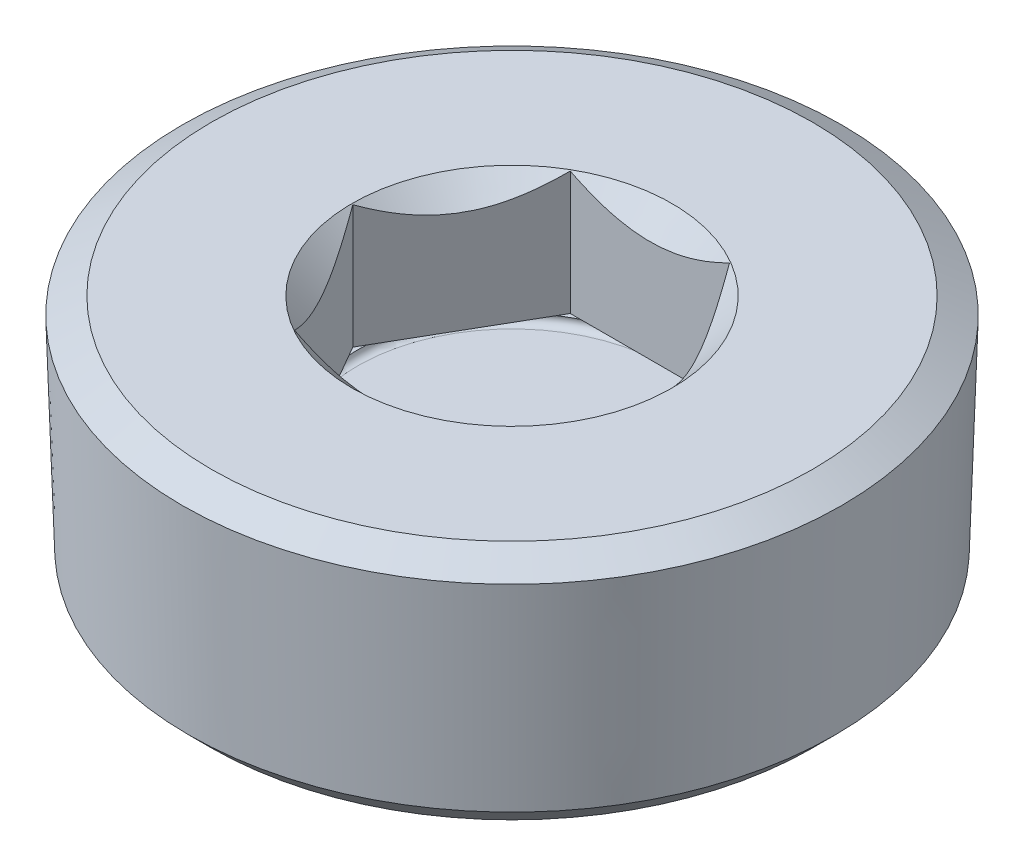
SolidWorks part; units mm, degrees
ref_plane "Front Plane" through (0, 0, 0) normal (0, 0, 1) x (1, 0, 0)
ref_plane "Top Plane" through (0, 0, 0) normal (0, 1, 0) x (1, 0, 0)
ref_plane "Right Plane" through (0, 0, 0) normal (1, 0, 0) x (0, 0, -1)
sketch "Sketch2" plane through (0, 0, 0) normal (0, 0, 1) x (1, 0, 0)
  line L0 (0, 10.7443) -> (0, -17.0657) construction
  line L1 (0, 0) -> (-27.6907, 0)
  line L2 (-30.3682, -1.5459) -> (-29.7882, -20.1275)
  line L3 (-27.6907, -22.225) -> (0, -22.225)
  line L4 (0, -22.225) -> (0, 0)
  line L6 (-27.6907, -22.225) -> (-29.7882, -20.1275)
  line L7 (-27.6907, 0) -> (-30.3682, -1.5459)
  point P4 (-30.4165, 0)
  point P6 (-29.7227, -22.225)
  dimension "D1" = 22.225
  dimension "D2" = 1.788
  dimension "D3" = 60.833
  dimension "D4" = 30
  dimension "D5" = 2.032
  dimension "D6" = 45
revolve "Revolve1" add sketch "Sketch2" angle 360 about L0
sketch "Sketch3" plane through (0, 0, 0) normal (0, 0, 1) x (1, 0, 0)
  line L0 (0, 2.9342) -> (0, -18.7525) construction
  line L1 (0, 0) -> (-14.732, 0)
  line L2 (27.6907, 0) -> (-27.6907, 0) construction
  line L3 (-12.7, -2.032) -> (-12.7, -11.43)
  line L4 (-14.224, -12.7) -> (0, -12.7)
  line L5 (0, -12.7) -> (0, 0)
  line L6 (-12.7, -2.032) -> (-14.732, 0)
  line L7 (-12.7, -11.43) -> (-14.224, -11.43)
  arc A0 (-14.224, -11.43) -> (-14.224, -12.7) centre (-14.224, -12.065) ccw
  dimension "D1" = 11.43
  dimension "D2" = 12.7
  dimension "D3" = 25.4
  dimension "D4" = 2.032
  dimension "D5" = 45
  dimension "D6" = 1.524
revolve "Cut-Revolve1" cut sketch "Sketch3" angle 360 about L0
sketch "Sketch4" plane through (0, 0, 0) normal (0, 1, 0) x (1, 0, 0)
  line L1 (-7.3323, -12.7) -> (7.3323, -12.7)
  line L2 (7.3323, -12.7) -> (14.6647, 0)
  line L3 (14.6647, 0) -> (7.3323, 12.7)
  line L4 (7.3323, 12.7) -> (-7.3323, 12.7)
  line L5 (-7.3323, 12.7) -> (-14.6647, 0)
  line L6 (-14.6647, 0) -> (-7.3323, -12.7)
  circle A0 centre (0, 0) radius 12.7 construction
  circle A1 centre (0, 0) radius 12.7 construction
  dimension "D1" = 25.4
extrude "Cut-Extrude1" cut sketch "Sketch4" against normal up to vertex (5.2929 mm away)
